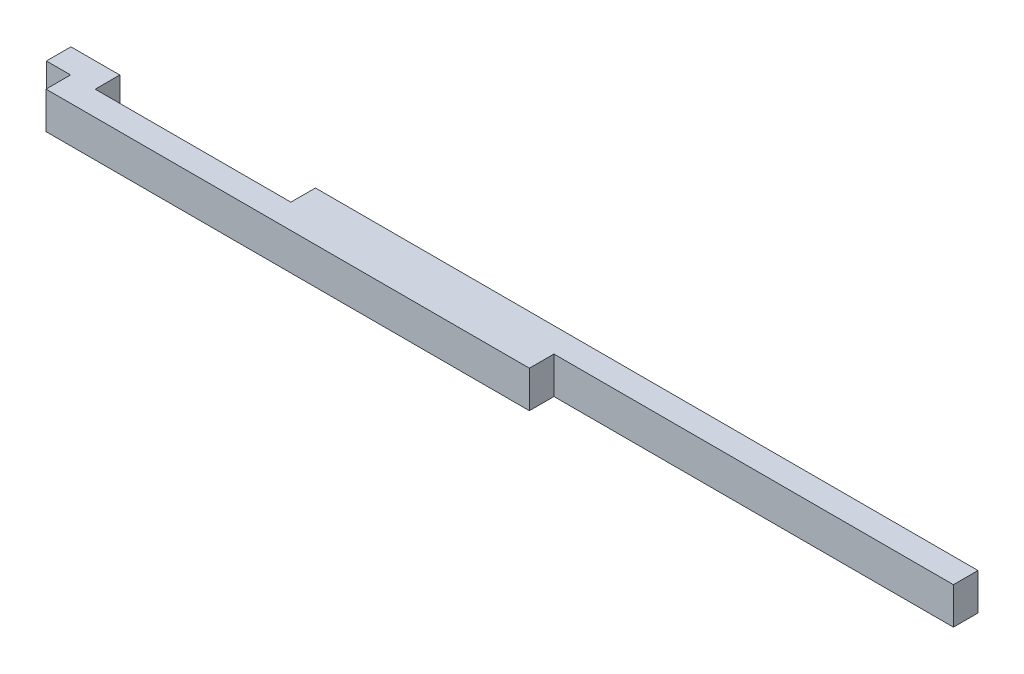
SolidWorks part; units mm, degrees
ref_plane "Front" through (0, 0, 0) normal (0, 0, 1) x (1, 0, 0)
ref_plane "Top" through (0, 0, 0) normal (0, 1, 0) x (1, 0, 0)
ref_plane "Right" through (0, 0, 0) normal (1, 0, 0) x (0, 0, -1)
sketch "Sketch1" plane through (0, 0, 0) normal (0, 1, 0) x (1, 0, 0)
  line L1 (0, 0) -> (100, 0)
  line L2 (0, 0) -> (0, 101.6)
  line L3 (0, 101.6) -> (202, 101.6)
  line L4 (2100, 0) -> (3752.9406, 0)
  line L5 (202, 0) -> (1011.56, 0)
  line L6 (100, 0) -> (100, -101.6)
  line L7 (100, -101.6) -> (1100, -101.6)
  line L11 (1100, -101.6) -> (2100, -101.6)
  line L12 (2100, 0) -> (2100, -101.6)
  line L13 (1011.56, 0) -> (1011.56, 101.6)
  line L14 (202, 101.6) -> (202, 0)
  line L15 (1011.56, 101.6) -> (3752.9406, 101.6)
  line L16 (3752.9406, 0) -> (3752.9406, 101.6)
  dimension "D1" = 101.6
  dimension "D2" = 101.6
  dimension "D3" = 202
  dimension "D4" = 1000
  dimension "D5" = 1000
  dimension "D6" = 100
  dimension "D7" = 101.6
  dimension "D8" = 809.56
  dimension "D9" = 2741.3806
  dimension "D10" = 101.6
  dimension "D11" = 203.2
extrude "Extrude1" add sketch "Sketch1" along normal blind 152.4
